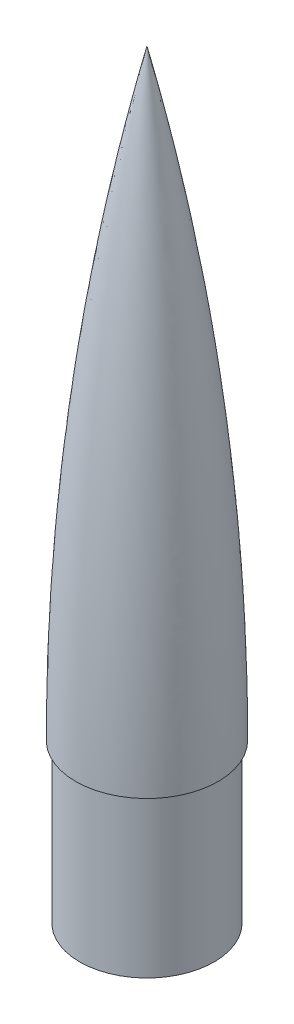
SolidWorks part; units mm, degrees
ref_plane "Front Plane" through (0, 0, 0) normal (0, 0, 1) x (1, 0, 0)
ref_plane "Top Plane" through (0, 0, 0) normal (0, 1, 0) x (1, 0, 0)
ref_plane "Right Plane" through (0, 0, 0) normal (1, 0, 0) x (0, 0, -1)
sketch "Sketch1" plane through (0, 0, 0) normal (0, 0, 1) x (1, 0, 0)
  line L0 (0, 0) -> (-26.9875, 0)
  line L1 (-26.9875, 63.5) -> (-26.9875, 0)
  line L2 (-26.9875, 63.5) -> (-28.575, 63.5)
  line L3 (0, 304.8) -> (0, 0) construction
  line L4 (0, 0) -> (0, 304.8)
  arc A0 (-28.575, 63.5) -> (0, 304.8) centre (1004.5347, 63.5) cw
  dimension "D1" = 26.9875
  dimension "D2" = 63.5
  dimension "D3" = 1.5875
  dimension "D4" = 304.8
revolve "Revolve1" add sketch "Sketch1" angle 360 about L3
shell "Shell1" thickness 1.5875
